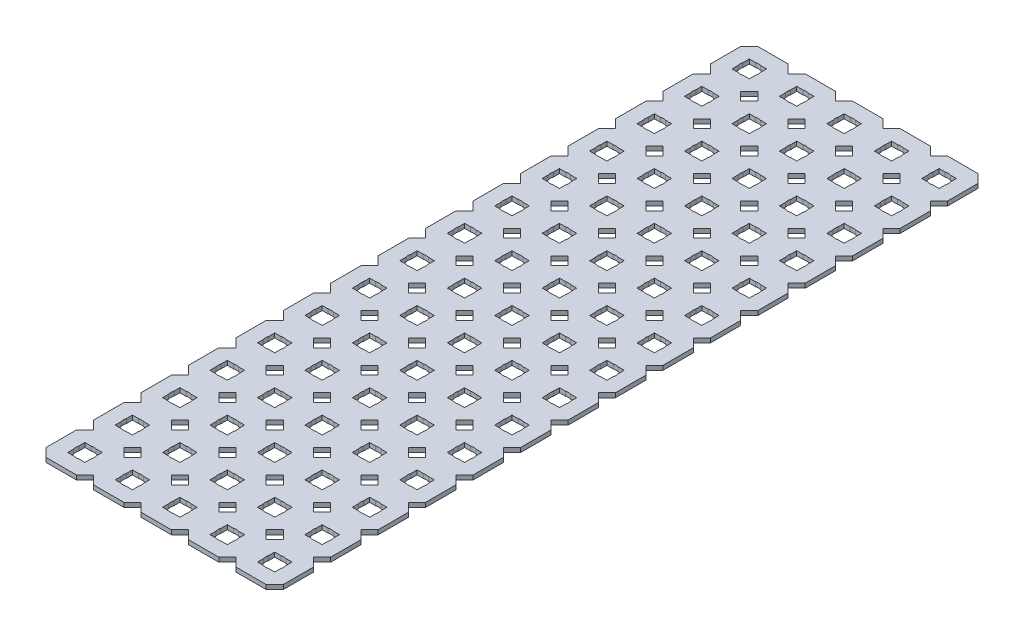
SolidWorks part; units mm, degrees
ref_plane "Front Plane" through (0, 0, 0) normal (0, 0, 1) x (1, 0, 0)
ref_plane "Top Plane" through (0, 0, 0) normal (0, 1, 0) x (1, 0, 0)
ref_plane "Right Plane" through (0, 0, 0) normal (1, 0, 0) x (0, 0, -1)
ref_plane "Plane1" through (0, 0, 0) normal (0, -1, 0) x (1, 0, 0)
sketch "Sketch1" plane through (0, 0, 0) normal (0, -1, 0) x (1, 0, 0)
  line L0 (2.281, -317.5) -> (10.419, -317.5)
  line L1 (10.419, -317.5) -> (12.7, -315.219)
  line L2 (12.7, -315.219) -> (14.981, -317.5)
  line L3 (14.981, -317.5) -> (23.119, -317.5)
  line L4 (23.119, -317.5) -> (25.4, -315.219)
  line L5 (25.4, -315.219) -> (27.681, -317.5)
  line L6 (27.681, -317.5) -> (35.819, -317.5)
  line L7 (35.819, -317.5) -> (38.1, -315.219)
  line L8 (38.1, -315.219) -> (40.381, -317.5)
  line L9 (40.381, -317.5) -> (48.519, -317.5)
  line L10 (48.519, -317.5) -> (50.8, -315.219)
  line L11 (50.8, -315.219) -> (53.081, -317.5)
  line L12 (53.081, -317.5) -> (61.219, -317.5)
  line L13 (61.219, -317.5) -> (63.5, -315.219)
  line L14 (63.5, -315.219) -> (63.5, -307.081)
  line L15 (63.5, -307.081) -> (61.219, -304.8)
  line L16 (61.219, -304.8) -> (63.5, -302.519)
  line L17 (63.5, -302.519) -> (63.5, -294.381)
  line L18 (63.5, -294.381) -> (61.219, -292.1)
  line L19 (61.219, -292.1) -> (63.5, -289.819)
  line L20 (63.5, -289.819) -> (63.5, -281.681)
  line L21 (63.5, -281.681) -> (61.219, -279.4)
  line L22 (61.219, -279.4) -> (63.5, -277.119)
  line L23 (63.5, -277.119) -> (63.5, -268.981)
  line L24 (63.5, -268.981) -> (61.219, -266.7)
  line L25 (61.219, -266.7) -> (63.5, -264.419)
  line L26 (63.5, -264.419) -> (63.5, -256.281)
  line L27 (63.5, -256.281) -> (61.219, -254)
  line L28 (61.219, -254) -> (63.5, -251.719)
  line L29 (63.5, -251.719) -> (63.5, -243.581)
  line L30 (63.5, -243.581) -> (61.219, -241.3)
  line L31 (61.219, -241.3) -> (63.5, -239.019)
  line L32 (63.5, -239.019) -> (63.5, -230.881)
  line L33 (63.5, -230.881) -> (61.219, -228.6)
  line L34 (61.219, -228.6) -> (63.5, -226.319)
  line L35 (63.5, -226.319) -> (63.5, -218.181)
  line L36 (63.5, -218.181) -> (61.219, -215.9)
  line L37 (61.219, -215.9) -> (63.5, -213.619)
  line L38 (63.5, -213.619) -> (63.5, -205.481)
  line L39 (63.5, -205.481) -> (61.219, -203.2)
  line L40 (61.219, -203.2) -> (63.5, -200.919)
  line L41 (63.5, -200.919) -> (63.5, -192.781)
  line L42 (63.5, -192.781) -> (61.219, -190.5)
  line L43 (61.219, -190.5) -> (63.5, -188.219)
  line L44 (63.5, -188.219) -> (63.5, -180.081)
  line L45 (63.5, -180.081) -> (61.219, -177.8)
  line L46 (61.219, -177.8) -> (63.5, -175.519)
  line L47 (63.5, -175.519) -> (63.5, -167.381)
  line L48 (63.5, -167.381) -> (61.219, -165.1)
  line L49 (61.219, -165.1) -> (63.5, -162.819)
  line L50 (63.5, -162.819) -> (63.5, -154.681)
  line L51 (63.5, -154.681) -> (61.219, -152.4)
  line L52 (61.219, -152.4) -> (63.5, -150.119)
  line L53 (63.5, -150.119) -> (63.5, -141.981)
  line L54 (63.5, -141.981) -> (61.219, -139.7)
  line L55 (61.219, -139.7) -> (63.5, -137.419)
  line L56 (63.5, -137.419) -> (63.5, -129.281)
  line L57 (63.5, -129.281) -> (61.219, -127)
  line L58 (61.219, -127) -> (63.5, -124.719)
  line L59 (63.5, -124.719) -> (63.5, -116.581)
  line L60 (63.5, -116.581) -> (61.219, -114.3)
  line L61 (61.219, -114.3) -> (63.5, -112.019)
  line L62 (63.5, -112.019) -> (63.5, -103.881)
  line L63 (63.5, -103.881) -> (61.219, -101.6)
  line L64 (61.219, -101.6) -> (63.5, -99.319)
  line L65 (63.5, -99.319) -> (63.5, -91.181)
  line L66 (63.5, -91.181) -> (61.219, -88.9)
  line L67 (61.219, -88.9) -> (63.5, -86.619)
  line L68 (63.5, -86.619) -> (63.5, -78.481)
  line L69 (63.5, -78.481) -> (61.219, -76.2)
  line L70 (61.219, -76.2) -> (63.5, -73.919)
  line L71 (63.5, -73.919) -> (63.5, -65.781)
  line L72 (63.5, -65.781) -> (61.219, -63.5)
  line L73 (61.219, -63.5) -> (63.5, -61.219)
  line L74 (63.5, -61.219) -> (63.5, -53.081)
  line L75 (63.5, -53.081) -> (61.219, -50.8)
  line L76 (61.219, -50.8) -> (63.5, -48.519)
  line L77 (63.5, -48.519) -> (63.5, -40.381)
  line L78 (63.5, -40.381) -> (61.219, -38.1)
  line L79 (61.219, -38.1) -> (63.5, -35.819)
  line L80 (63.5, -35.819) -> (63.5, -27.681)
  line L81 (63.5, -27.681) -> (61.219, -25.4)
  line L82 (61.219, -25.4) -> (63.5, -23.119)
  line L83 (63.5, -23.119) -> (63.5, -14.981)
  line L84 (63.5, -14.981) -> (61.219, -12.7)
  line L85 (61.219, -12.7) -> (63.5, -10.419)
  line L86 (63.5, -10.419) -> (63.5, -2.281)
  line L87 (63.5, -2.281) -> (61.219, 0)
  line L88 (61.219, 0) -> (53.081, 0)
  line L89 (53.081, 0) -> (50.8, -2.281)
  line L90 (50.8, -2.281) -> (48.519, 0)
  line L91 (48.519, 0) -> (40.381, 0)
  line L92 (40.381, 0) -> (38.1, -2.281)
  line L93 (38.1, -2.281) -> (35.819, 0)
  line L94 (35.819, 0) -> (27.681, 0)
  line L95 (27.681, 0) -> (25.4, -2.281)
  line L96 (25.4, -2.281) -> (23.119, 0)
  line L97 (23.119, 0) -> (14.981, 0)
  line L98 (14.981, 0) -> (12.7, -2.281)
  line L99 (12.7, -2.281) -> (10.419, 0)
  line L100 (10.419, 0) -> (2.281, 0)
  line L101 (2.281, 0) -> (0, -2.281)
  line L102 (0, -2.281) -> (0, -10.419)
  line L103 (0, -10.419) -> (2.281, -12.7)
  line L104 (2.281, -12.7) -> (0, -14.981)
  line L105 (0, -14.981) -> (0, -23.119)
  line L106 (0, -23.119) -> (2.281, -25.4)
  line L107 (2.281, -25.4) -> (0, -27.681)
  line L108 (0, -27.681) -> (0, -35.819)
  line L109 (0, -35.819) -> (2.281, -38.1)
  line L110 (2.281, -38.1) -> (0, -40.381)
  line L111 (0, -40.381) -> (0, -48.519)
  line L112 (0, -48.519) -> (2.281, -50.8)
  line L113 (2.281, -50.8) -> (0, -53.081)
  line L114 (0, -53.081) -> (0, -61.219)
  line L115 (0, -61.219) -> (2.281, -63.5)
  line L116 (2.281, -63.5) -> (0, -65.781)
  line L117 (0, -65.781) -> (0, -73.919)
  line L118 (0, -73.919) -> (2.281, -76.2)
  line L119 (2.281, -76.2) -> (0, -78.481)
  line L120 (0, -78.481) -> (0, -86.619)
  line L121 (0, -86.619) -> (2.281, -88.9)
  line L122 (2.281, -88.9) -> (0, -91.181)
  line L123 (0, -91.181) -> (0, -99.319)
  line L124 (0, -99.319) -> (2.281, -101.6)
  line L125 (2.281, -101.6) -> (0, -103.881)
  line L126 (0, -103.881) -> (0, -112.019)
  line L127 (0, -112.019) -> (2.281, -114.3)
  line L128 (2.281, -114.3) -> (0, -116.581)
  line L129 (0, -116.581) -> (0, -124.719)
  line L130 (0, -124.719) -> (2.281, -127)
  line L131 (2.281, -127) -> (0, -129.281)
  line L132 (0, -129.281) -> (0, -137.419)
  line L133 (0, -137.419) -> (2.281, -139.7)
  line L134 (2.281, -139.7) -> (0, -141.981)
  line L135 (0, -141.981) -> (0, -150.119)
  line L136 (0, -150.119) -> (2.281, -152.4)
  line L137 (2.281, -152.4) -> (0, -154.681)
  line L138 (0, -154.681) -> (0, -162.819)
  line L139 (0, -162.819) -> (2.281, -165.1)
  line L140 (2.281, -165.1) -> (0, -167.381)
  line L141 (0, -167.381) -> (0, -175.519)
  line L142 (0, -175.519) -> (2.281, -177.8)
  line L143 (2.281, -177.8) -> (0, -180.081)
  line L144 (0, -180.081) -> (0, -188.219)
  line L145 (0, -188.219) -> (2.281, -190.5)
  line L146 (2.281, -190.5) -> (0, -192.781)
  line L147 (0, -192.781) -> (0, -200.919)
  line L148 (0, -200.919) -> (2.281, -203.2)
  line L149 (2.281, -203.2) -> (0, -205.481)
  line L150 (0, -205.481) -> (0, -213.619)
  line L151 (0, -213.619) -> (2.281, -215.9)
  line L152 (2.281, -215.9) -> (0, -218.181)
  line L153 (0, -218.181) -> (0, -226.319)
  line L154 (0, -226.319) -> (2.281, -228.6)
  line L155 (2.281, -228.6) -> (0, -230.881)
  line L156 (0, -230.881) -> (0, -239.019)
  line L157 (0, -239.019) -> (2.281, -241.3)
  line L158 (2.281, -241.3) -> (0, -243.581)
  line L159 (0, -243.581) -> (0, -251.719)
  line L160 (0, -251.719) -> (2.281, -254)
  line L161 (2.281, -254) -> (0, -256.281)
  line L162 (0, -256.281) -> (0, -264.419)
  line L163 (0, -264.419) -> (2.281, -266.7)
  line L164 (2.281, -266.7) -> (0, -268.981)
  line L165 (0, -268.981) -> (0, -277.119)
  line L166 (0, -277.119) -> (2.281, -279.4)
  line L167 (2.281, -279.4) -> (0, -281.681)
  line L168 (0, -281.681) -> (0, -289.819)
  line L169 (0, -289.819) -> (2.281, -292.1)
  line L170 (2.281, -292.1) -> (0, -294.381)
  line L171 (0, -294.381) -> (0, -302.519)
  line L172 (0, -302.519) -> (2.281, -304.8)
  line L173 (2.281, -304.8) -> (0, -307.081)
  line L174 (0, -307.081) -> (0, -315.219)
  line L175 (0, -315.219) -> (2.281, -317.5)
  line L176 (14.981, -292.1) -> (12.7, -294.381)
  line L177 (12.7, -294.381) -> (10.419, -292.1)
  line L178 (10.419, -292.1) -> (12.7, -289.819)
  line L179 (12.7, -289.819) -> (14.981, -292.1)
  line L180 (14.981, -266.7) -> (12.7, -268.981)
  line L181 (12.7, -268.981) -> (10.419, -266.7)
  line L182 (10.419, -266.7) -> (12.7, -264.419)
  line L183 (12.7, -264.419) -> (14.981, -266.7)
  line L184 (14.981, -241.3) -> (12.7, -243.581)
  line L185 (12.7, -243.581) -> (10.419, -241.3)
  line L186 (10.419, -241.3) -> (12.7, -239.019)
  line L187 (12.7, -239.019) -> (14.981, -241.3)
  line L188 (14.981, -215.9) -> (12.7, -218.181)
  line L189 (12.7, -218.181) -> (10.419, -215.9)
  line L190 (10.419, -215.9) -> (12.7, -213.619)
  line L191 (12.7, -213.619) -> (14.981, -215.9)
  line L192 (14.981, -190.5) -> (12.7, -192.781)
  line L193 (12.7, -192.781) -> (10.419, -190.5)
  line L194 (10.419, -190.5) -> (12.7, -188.219)
  line L195 (12.7, -188.219) -> (14.981, -190.5)
  line L196 (14.981, -165.1) -> (12.7, -167.381)
  line L197 (12.7, -167.381) -> (10.419, -165.1)
  line L198 (10.419, -165.1) -> (12.7, -162.819)
  line L199 (12.7, -162.819) -> (14.981, -165.1)
  line L200 (14.981, -139.7) -> (12.7, -141.981)
  line L201 (12.7, -141.981) -> (10.419, -139.7)
  line L202 (10.419, -139.7) -> (12.7, -137.419)
  line L203 (12.7, -137.419) -> (14.981, -139.7)
  line L204 (14.981, -114.3) -> (12.7, -116.581)
  line L205 (12.7, -116.581) -> (10.419, -114.3)
  line L206 (10.419, -114.3) -> (12.7, -112.019)
  line L207 (12.7, -112.019) -> (14.981, -114.3)
  line L208 (14.981, -88.9) -> (12.7, -91.181)
  line L209 (12.7, -91.181) -> (10.419, -88.9)
  line L210 (10.419, -88.9) -> (12.7, -86.619)
  line L211 (12.7, -86.619) -> (14.981, -88.9)
  line L212 (14.981, -63.5) -> (12.7, -65.781)
  line L213 (12.7, -65.781) -> (10.419, -63.5)
  line L214 (10.419, -63.5) -> (12.7, -61.219)
  line L215 (12.7, -61.219) -> (14.981, -63.5)
  line L216 (14.981, -38.1) -> (12.7, -40.381)
  line L217 (12.7, -40.381) -> (10.419, -38.1)
  line L218 (10.419, -38.1) -> (12.7, -35.819)
  line L219 (12.7, -35.819) -> (14.981, -38.1)
  line L220 (14.981, -12.7) -> (12.7, -14.981)
  line L221 (12.7, -14.981) -> (10.419, -12.7)
  line L222 (10.419, -12.7) -> (12.7, -10.419)
  line L223 (12.7, -10.419) -> (14.981, -12.7)
  line L224 (27.681, -304.8) -> (25.4, -307.081)
  line L225 (25.4, -307.081) -> (23.119, -304.8)
  line L226 (23.119, -304.8) -> (25.4, -302.519)
  line L227 (25.4, -302.519) -> (27.681, -304.8)
  line L228 (27.681, -279.4) -> (25.4, -281.681)
  line L229 (25.4, -281.681) -> (23.119, -279.4)
  line L230 (23.119, -279.4) -> (25.4, -277.119)
  line L231 (25.4, -277.119) -> (27.681, -279.4)
  line L232 (27.681, -254) -> (25.4, -256.281)
  line L233 (25.4, -256.281) -> (23.119, -254)
  line L234 (23.119, -254) -> (25.4, -251.719)
  line L235 (25.4, -251.719) -> (27.681, -254)
  line L236 (27.681, -228.6) -> (25.4, -230.881)
  line L237 (25.4, -230.881) -> (23.119, -228.6)
  line L238 (23.119, -228.6) -> (25.4, -226.319)
  line L239 (25.4, -226.319) -> (27.681, -228.6)
  line L240 (27.681, -203.2) -> (25.4, -205.481)
  line L241 (25.4, -205.481) -> (23.119, -203.2)
  line L242 (23.119, -203.2) -> (25.4, -200.919)
  line L243 (25.4, -200.919) -> (27.681, -203.2)
  line L244 (27.681, -177.8) -> (25.4, -180.081)
  line L245 (25.4, -180.081) -> (23.119, -177.8)
  line L246 (23.119, -177.8) -> (25.4, -175.519)
  line L247 (25.4, -175.519) -> (27.681, -177.8)
  line L248 (27.681, -152.4) -> (25.4, -154.681)
  line L249 (25.4, -154.681) -> (23.119, -152.4)
  line L250 (23.119, -152.4) -> (25.4, -150.119)
  line L251 (25.4, -150.119) -> (27.681, -152.4)
  line L252 (27.681, -127) -> (25.4, -129.281)
  line L253 (25.4, -129.281) -> (23.119, -127)
  line L254 (23.119, -127) -> (25.4, -124.719)
  line L255 (25.4, -124.719) -> (27.681, -127)
  line L256 (27.681, -101.6) -> (25.4, -103.881)
  line L257 (25.4, -103.881) -> (23.119, -101.6)
  line L258 (23.119, -101.6) -> (25.4, -99.319)
  line L259 (25.4, -99.319) -> (27.681, -101.6)
  line L260 (27.681, -76.2) -> (25.4, -78.481)
  line L261 (25.4, -78.481) -> (23.119, -76.2)
  line L262 (23.119, -76.2) -> (25.4, -73.919)
  line L263 (25.4, -73.919) -> (27.681, -76.2)
  line L264 (27.681, -50.8) -> (25.4, -53.081)
  line L265 (25.4, -53.081) -> (23.119, -50.8)
  line L266 (23.119, -50.8) -> (25.4, -48.519)
  line L267 (25.4, -48.519) -> (27.681, -50.8)
  line L268 (27.681, -25.4) -> (25.4, -27.681)
  line L269 (25.4, -27.681) -> (23.119, -25.4)
  line L270 (23.119, -25.4) -> (25.4, -23.119)
  line L271 (25.4, -23.119) -> (27.681, -25.4)
  line L272 (40.381, -292.1) -> (38.1, -294.381)
  line L273 (38.1, -294.381) -> (35.819, -292.1)
  line L274 (35.819, -292.1) -> (38.1, -289.819)
  line L275 (38.1, -289.819) -> (40.381, -292.1)
  line L276 (40.381, -266.7) -> (38.1, -268.981)
  line L277 (38.1, -268.981) -> (35.819, -266.7)
  line L278 (35.819, -266.7) -> (38.1, -264.419)
  line L279 (38.1, -264.419) -> (40.381, -266.7)
  line L280 (40.381, -241.3) -> (38.1, -243.581)
  line L281 (38.1, -243.581) -> (35.819, -241.3)
  line L282 (35.819, -241.3) -> (38.1, -239.019)
  line L283 (38.1, -239.019) -> (40.381, -241.3)
  line L284 (40.381, -215.9) -> (38.1, -218.181)
  line L285 (38.1, -218.181) -> (35.819, -215.9)
  line L286 (35.819, -215.9) -> (38.1, -213.619)
  line L287 (38.1, -213.619) -> (40.381, -215.9)
  line L288 (40.381, -190.5) -> (38.1, -192.781)
  line L289 (38.1, -192.781) -> (35.819, -190.5)
  line L290 (35.819, -190.5) -> (38.1, -188.219)
  line L291 (38.1, -188.219) -> (40.381, -190.5)
  line L292 (40.381, -165.1) -> (38.1, -167.381)
  line L293 (38.1, -167.381) -> (35.819, -165.1)
  line L294 (35.819, -165.1) -> (38.1, -162.819)
  line L295 (38.1, -162.819) -> (40.381, -165.1)
  line L296 (40.381, -139.7) -> (38.1, -141.981)
  line L297 (38.1, -141.981) -> (35.819, -139.7)
  line L298 (35.819, -139.7) -> (38.1, -137.419)
  line L299 (38.1, -137.419) -> (40.381, -139.7)
  line L300 (40.381, -114.3) -> (38.1, -116.581)
  line L301 (38.1, -116.581) -> (35.819, -114.3)
  line L302 (35.819, -114.3) -> (38.1, -112.019)
  line L303 (38.1, -112.019) -> (40.381, -114.3)
  line L304 (40.381, -88.9) -> (38.1, -91.181)
  line L305 (38.1, -91.181) -> (35.819, -88.9)
  line L306 (35.819, -88.9) -> (38.1, -86.619)
  line L307 (38.1, -86.619) -> (40.381, -88.9)
  line L308 (40.381, -63.5) -> (38.1, -65.781)
  line L309 (38.1, -65.781) -> (35.819, -63.5)
  line L310 (35.819, -63.5) -> (38.1, -61.219)
  line L311 (38.1, -61.219) -> (40.381, -63.5)
  line L312 (40.381, -38.1) -> (38.1, -40.381)
  line L313 (38.1, -40.381) -> (35.819, -38.1)
  line L314 (35.819, -38.1) -> (38.1, -35.819)
  line L315 (38.1, -35.819) -> (40.381, -38.1)
  line L316 (40.381, -12.7) -> (38.1, -14.981)
  line L317 (38.1, -14.981) -> (35.819, -12.7)
  line L318 (35.819, -12.7) -> (38.1, -10.419)
  line L319 (38.1, -10.419) -> (40.381, -12.7)
  line L320 (53.081, -304.8) -> (50.8, -307.081)
  line L321 (50.8, -307.081) -> (48.519, -304.8)
  line L322 (48.519, -304.8) -> (50.8, -302.519)
  line L323 (50.8, -302.519) -> (53.081, -304.8)
  line L324 (53.081, -279.4) -> (50.8, -281.681)
  line L325 (50.8, -281.681) -> (48.519, -279.4)
  line L326 (48.519, -279.4) -> (50.8, -277.119)
  line L327 (50.8, -277.119) -> (53.081, -279.4)
  line L328 (53.081, -254) -> (50.8, -256.281)
  line L329 (50.8, -256.281) -> (48.519, -254)
  line L330 (48.519, -254) -> (50.8, -251.719)
  line L331 (50.8, -251.719) -> (53.081, -254)
  line L332 (53.081, -228.6) -> (50.8, -230.881)
  line L333 (50.8, -230.881) -> (48.519, -228.6)
  line L334 (48.519, -228.6) -> (50.8, -226.319)
  line L335 (50.8, -226.319) -> (53.081, -228.6)
  line L336 (53.081, -203.2) -> (50.8, -205.481)
  line L337 (50.8, -205.481) -> (48.519, -203.2)
  line L338 (48.519, -203.2) -> (50.8, -200.919)
  line L339 (50.8, -200.919) -> (53.081, -203.2)
  line L340 (53.081, -177.8) -> (50.8, -180.081)
  line L341 (50.8, -180.081) -> (48.519, -177.8)
  line L342 (48.519, -177.8) -> (50.8, -175.519)
  line L343 (50.8, -175.519) -> (53.081, -177.8)
  line L344 (53.081, -152.4) -> (50.8, -154.681)
  line L345 (50.8, -154.681) -> (48.519, -152.4)
  line L346 (48.519, -152.4) -> (50.8, -150.119)
  line L347 (50.8, -150.119) -> (53.081, -152.4)
  line L348 (53.081, -127) -> (50.8, -129.281)
  line L349 (50.8, -129.281) -> (48.519, -127)
  line L350 (48.519, -127) -> (50.8, -124.719)
  line L351 (50.8, -124.719) -> (53.081, -127)
  line L352 (53.081, -101.6) -> (50.8, -103.881)
  line L353 (50.8, -103.881) -> (48.519, -101.6)
  line L354 (48.519, -101.6) -> (50.8, -99.319)
  line L355 (50.8, -99.319) -> (53.081, -101.6)
  line L356 (53.081, -76.2) -> (50.8, -78.481)
  line L357 (50.8, -78.481) -> (48.519, -76.2)
  line L358 (48.519, -76.2) -> (50.8, -73.919)
  line L359 (50.8, -73.919) -> (53.081, -76.2)
  line L360 (53.081, -50.8) -> (50.8, -53.081)
  line L361 (50.8, -53.081) -> (48.519, -50.8)
  line L362 (48.519, -50.8) -> (50.8, -48.519)
  line L363 (50.8, -48.519) -> (53.081, -50.8)
  line L364 (53.081, -25.4) -> (50.8, -27.681)
  line L365 (50.8, -27.681) -> (48.519, -25.4)
  line L366 (48.519, -25.4) -> (50.8, -23.119)
  line L367 (50.8, -23.119) -> (53.081, -25.4)
  line L368 (4.0386, -308.8386) -> (8.6614, -308.8386)
  line L369 (8.6614, -308.8386) -> (8.6614, -313.4614)
  line L370 (8.6614, -313.4614) -> (4.0386, -313.4614)
  line L371 (4.0386, -313.4614) -> (4.0386, -308.8386)
  line L372 (16.7386, -308.8386) -> (21.3614, -308.8386)
  line L373 (21.3614, -308.8386) -> (21.3614, -313.4614)
  line L374 (21.3614, -313.4614) -> (16.7386, -313.4614)
  line L375 (16.7386, -313.4614) -> (16.7386, -308.8386)
  line L376 (29.4386, -308.8386) -> (34.0614, -308.8386)
  line L377 (34.0614, -308.8386) -> (34.0614, -313.4614)
  line L378 (34.0614, -313.4614) -> (29.4386, -313.4614)
  line L379 (29.4386, -313.4614) -> (29.4386, -308.8386)
  line L380 (42.1386, -308.8386) -> (46.7614, -308.8386)
  line L381 (46.7614, -308.8386) -> (46.7614, -313.4614)
  line L382 (46.7614, -313.4614) -> (42.1386, -313.4614)
  line L383 (42.1386, -313.4614) -> (42.1386, -308.8386)
  line L384 (54.8386, -308.8386) -> (59.4614, -308.8386)
  line L385 (59.4614, -308.8386) -> (59.4614, -313.4614)
  line L386 (59.4614, -313.4614) -> (54.8386, -313.4614)
  line L387 (54.8386, -313.4614) -> (54.8386, -308.8386)
  line L388 (4.0386, -296.1386) -> (8.6614, -296.1386)
  line L389 (8.6614, -296.1386) -> (8.6614, -300.7614)
  line L390 (8.6614, -300.7614) -> (4.0386, -300.7614)
  line L391 (4.0386, -300.7614) -> (4.0386, -296.1386)
  line L392 (54.8386, -296.1386) -> (59.4614, -296.1386)
  line L393 (59.4614, -296.1386) -> (59.4614, -300.7614)
  line L394 (59.4614, -300.7614) -> (54.8386, -300.7614)
  line L395 (54.8386, -300.7614) -> (54.8386, -296.1386)
  line L396 (4.0386, -283.4386) -> (8.6614, -283.4386)
  line L397 (8.6614, -283.4386) -> (8.6614, -288.0614)
  line L398 (8.6614, -288.0614) -> (4.0386, -288.0614)
  line L399 (4.0386, -288.0614) -> (4.0386, -283.4386)
  line L400 (54.8386, -283.4386) -> (59.4614, -283.4386)
  line L401 (59.4614, -283.4386) -> (59.4614, -288.0614)
  line L402 (59.4614, -288.0614) -> (54.8386, -288.0614)
  line L403 (54.8386, -288.0614) -> (54.8386, -283.4386)
  line L404 (4.0386, -270.7386) -> (8.6614, -270.7386)
  line L405 (8.6614, -270.7386) -> (8.6614, -275.3614)
  line L406 (8.6614, -275.3614) -> (4.0386, -275.3614)
  line L407 (4.0386, -275.3614) -> (4.0386, -270.7386)
  line L408 (54.8386, -270.7386) -> (59.4614, -270.7386)
  line L409 (59.4614, -270.7386) -> (59.4614, -275.3614)
  line L410 (59.4614, -275.3614) -> (54.8386, -275.3614)
  line L411 (54.8386, -275.3614) -> (54.8386, -270.7386)
  line L412 (4.0386, -258.0386) -> (8.6614, -258.0386)
  line L413 (8.6614, -258.0386) -> (8.6614, -262.6614)
  line L414 (8.6614, -262.6614) -> (4.0386, -262.6614)
  line L415 (4.0386, -262.6614) -> (4.0386, -258.0386)
  line L416 (54.8386, -258.0386) -> (59.4614, -258.0386)
  line L417 (59.4614, -258.0386) -> (59.4614, -262.6614)
  line L418 (59.4614, -262.6614) -> (54.8386, -262.6614)
  line L419 (54.8386, -262.6614) -> (54.8386, -258.0386)
  line L420 (4.0386, -245.3386) -> (8.6614, -245.3386)
  line L421 (8.6614, -245.3386) -> (8.6614, -249.9614)
  line L422 (8.6614, -249.9614) -> (4.0386, -249.9614)
  line L423 (4.0386, -249.9614) -> (4.0386, -245.3386)
  line L424 (54.8386, -245.3386) -> (59.4614, -245.3386)
  line L425 (59.4614, -245.3386) -> (59.4614, -249.9614)
  line L426 (59.4614, -249.9614) -> (54.8386, -249.9614)
  line L427 (54.8386, -249.9614) -> (54.8386, -245.3386)
  line L428 (4.0386, -232.6386) -> (8.6614, -232.6386)
  line L429 (8.6614, -232.6386) -> (8.6614, -237.2614)
  line L430 (8.6614, -237.2614) -> (4.0386, -237.2614)
  line L431 (4.0386, -237.2614) -> (4.0386, -232.6386)
  line L432 (54.8386, -232.6386) -> (59.4614, -232.6386)
  line L433 (59.4614, -232.6386) -> (59.4614, -237.2614)
  line L434 (59.4614, -237.2614) -> (54.8386, -237.2614)
  line L435 (54.8386, -237.2614) -> (54.8386, -232.6386)
  line L436 (4.0386, -219.9386) -> (8.6614, -219.9386)
  line L437 (8.6614, -219.9386) -> (8.6614, -224.5614)
  line L438 (8.6614, -224.5614) -> (4.0386, -224.5614)
  line L439 (4.0386, -224.5614) -> (4.0386, -219.9386)
  line L440 (54.8386, -219.9386) -> (59.4614, -219.9386)
  line L441 (59.4614, -219.9386) -> (59.4614, -224.5614)
  line L442 (59.4614, -224.5614) -> (54.8386, -224.5614)
  line L443 (54.8386, -224.5614) -> (54.8386, -219.9386)
  line L444 (4.0386, -207.2386) -> (8.6614, -207.2386)
  line L445 (8.6614, -207.2386) -> (8.6614, -211.8614)
  line L446 (8.6614, -211.8614) -> (4.0386, -211.8614)
  line L447 (4.0386, -211.8614) -> (4.0386, -207.2386)
  line L448 (54.8386, -207.2386) -> (59.4614, -207.2386)
  line L449 (59.4614, -207.2386) -> (59.4614, -211.8614)
  line L450 (59.4614, -211.8614) -> (54.8386, -211.8614)
  line L451 (54.8386, -211.8614) -> (54.8386, -207.2386)
  line L452 (4.0386, -194.5386) -> (8.6614, -194.5386)
  line L453 (8.6614, -194.5386) -> (8.6614, -199.1614)
  line L454 (8.6614, -199.1614) -> (4.0386, -199.1614)
  line L455 (4.0386, -199.1614) -> (4.0386, -194.5386)
  line L456 (54.8386, -194.5386) -> (59.4614, -194.5386)
  line L457 (59.4614, -194.5386) -> (59.4614, -199.1614)
  line L458 (59.4614, -199.1614) -> (54.8386, -199.1614)
  line L459 (54.8386, -199.1614) -> (54.8386, -194.5386)
  line L460 (4.0386, -181.8386) -> (8.6614, -181.8386)
  line L461 (8.6614, -181.8386) -> (8.6614, -186.4614)
  line L462 (8.6614, -186.4614) -> (4.0386, -186.4614)
  line L463 (4.0386, -186.4614) -> (4.0386, -181.8386)
  line L464 (54.8386, -181.8386) -> (59.4614, -181.8386)
  line L465 (59.4614, -181.8386) -> (59.4614, -186.4614)
  line L466 (59.4614, -186.4614) -> (54.8386, -186.4614)
  line L467 (54.8386, -186.4614) -> (54.8386, -181.8386)
  line L468 (4.0386, -169.1386) -> (8.6614, -169.1386)
  line L469 (8.6614, -169.1386) -> (8.6614, -173.7614)
  line L470 (8.6614, -173.7614) -> (4.0386, -173.7614)
  line L471 (4.0386, -173.7614) -> (4.0386, -169.1386)
  line L472 (54.8386, -169.1386) -> (59.4614, -169.1386)
  line L473 (59.4614, -169.1386) -> (59.4614, -173.7614)
  line L474 (59.4614, -173.7614) -> (54.8386, -173.7614)
  line L475 (54.8386, -173.7614) -> (54.8386, -169.1386)
  line L476 (4.0386, -156.4386) -> (8.6614, -156.4386)
  line L477 (8.6614, -156.4386) -> (8.6614, -161.0614)
  line L478 (8.6614, -161.0614) -> (4.0386, -161.0614)
  line L479 (4.0386, -161.0614) -> (4.0386, -156.4386)
  line L480 (54.8386, -156.4386) -> (59.4614, -156.4386)
  line L481 (59.4614, -156.4386) -> (59.4614, -161.0614)
  line L482 (59.4614, -161.0614) -> (54.8386, -161.0614)
  line L483 (54.8386, -161.0614) -> (54.8386, -156.4386)
  line L484 (4.0386, -143.7386) -> (8.6614, -143.7386)
  line L485 (8.6614, -143.7386) -> (8.6614, -148.3614)
  line L486 (8.6614, -148.3614) -> (4.0386, -148.3614)
  line L487 (4.0386, -148.3614) -> (4.0386, -143.7386)
  line L488 (54.8386, -143.7386) -> (59.4614, -143.7386)
  line L489 (59.4614, -143.7386) -> (59.4614, -148.3614)
  line L490 (59.4614, -148.3614) -> (54.8386, -148.3614)
  line L491 (54.8386, -148.3614) -> (54.8386, -143.7386)
  line L492 (4.0386, -131.0386) -> (8.6614, -131.0386)
  line L493 (8.6614, -131.0386) -> (8.6614, -135.6614)
  line L494 (8.6614, -135.6614) -> (4.0386, -135.6614)
  line L495 (4.0386, -135.6614) -> (4.0386, -131.0386)
  line L496 (54.8386, -131.0386) -> (59.4614, -131.0386)
  line L497 (59.4614, -131.0386) -> (59.4614, -135.6614)
  line L498 (59.4614, -135.6614) -> (54.8386, -135.6614)
  line L499 (54.8386, -135.6614) -> (54.8386, -131.0386)
  line L500 (4.0386, -118.3386) -> (8.6614, -118.3386)
  line L501 (8.6614, -118.3386) -> (8.6614, -122.9614)
  line L502 (8.6614, -122.9614) -> (4.0386, -122.9614)
  line L503 (4.0386, -122.9614) -> (4.0386, -118.3386)
  line L504 (54.8386, -118.3386) -> (59.4614, -118.3386)
  line L505 (59.4614, -118.3386) -> (59.4614, -122.9614)
  line L506 (59.4614, -122.9614) -> (54.8386, -122.9614)
  line L507 (54.8386, -122.9614) -> (54.8386, -118.3386)
  line L508 (4.0386, -105.6386) -> (8.6614, -105.6386)
  line L509 (8.6614, -105.6386) -> (8.6614, -110.2614)
  line L510 (8.6614, -110.2614) -> (4.0386, -110.2614)
  line L511 (4.0386, -110.2614) -> (4.0386, -105.6386)
  line L512 (54.8386, -105.6386) -> (59.4614, -105.6386)
  line L513 (59.4614, -105.6386) -> (59.4614, -110.2614)
  line L514 (59.4614, -110.2614) -> (54.8386, -110.2614)
  line L515 (54.8386, -110.2614) -> (54.8386, -105.6386)
  line L516 (4.0386, -92.9386) -> (8.6614, -92.9386)
  line L517 (8.6614, -92.9386) -> (8.6614, -97.5614)
  line L518 (8.6614, -97.5614) -> (4.0386, -97.5614)
  line L519 (4.0386, -97.5614) -> (4.0386, -92.9386)
  line L520 (54.8386, -92.9386) -> (59.4614, -92.9386)
  line L521 (59.4614, -92.9386) -> (59.4614, -97.5614)
  line L522 (59.4614, -97.5614) -> (54.8386, -97.5614)
  line L523 (54.8386, -97.5614) -> (54.8386, -92.9386)
  line L524 (4.0386, -80.2386) -> (8.6614, -80.2386)
  line L525 (8.6614, -80.2386) -> (8.6614, -84.8614)
  line L526 (8.6614, -84.8614) -> (4.0386, -84.8614)
  line L527 (4.0386, -84.8614) -> (4.0386, -80.2386)
  line L528 (54.8386, -80.2386) -> (59.4614, -80.2386)
  line L529 (59.4614, -80.2386) -> (59.4614, -84.8614)
  line L530 (59.4614, -84.8614) -> (54.8386, -84.8614)
  line L531 (54.8386, -84.8614) -> (54.8386, -80.2386)
  line L532 (4.0386, -67.5386) -> (8.6614, -67.5386)
  line L533 (8.6614, -67.5386) -> (8.6614, -72.1614)
  line L534 (8.6614, -72.1614) -> (4.0386, -72.1614)
  line L535 (4.0386, -72.1614) -> (4.0386, -67.5386)
  line L536 (54.8386, -67.5386) -> (59.4614, -67.5386)
  line L537 (59.4614, -67.5386) -> (59.4614, -72.1614)
  line L538 (59.4614, -72.1614) -> (54.8386, -72.1614)
  line L539 (54.8386, -72.1614) -> (54.8386, -67.5386)
  line L540 (4.0386, -54.8386) -> (8.6614, -54.8386)
  line L541 (8.6614, -54.8386) -> (8.6614, -59.4614)
  line L542 (8.6614, -59.4614) -> (4.0386, -59.4614)
  line L543 (4.0386, -59.4614) -> (4.0386, -54.8386)
  line L544 (54.8386, -54.8386) -> (59.4614, -54.8386)
  line L545 (59.4614, -54.8386) -> (59.4614, -59.4614)
  line L546 (59.4614, -59.4614) -> (54.8386, -59.4614)
  line L547 (54.8386, -59.4614) -> (54.8386, -54.8386)
  line L548 (4.0386, -42.1386) -> (8.6614, -42.1386)
  line L549 (8.6614, -42.1386) -> (8.6614, -46.7614)
  line L550 (8.6614, -46.7614) -> (4.0386, -46.7614)
  line L551 (4.0386, -46.7614) -> (4.0386, -42.1386)
  line L552 (54.8386, -42.1386) -> (59.4614, -42.1386)
  line L553 (59.4614, -42.1386) -> (59.4614, -46.7614)
  line L554 (59.4614, -46.7614) -> (54.8386, -46.7614)
  line L555 (54.8386, -46.7614) -> (54.8386, -42.1386)
  line L556 (4.0386, -29.4386) -> (8.6614, -29.4386)
  line L557 (8.6614, -29.4386) -> (8.6614, -34.0614)
  line L558 (8.6614, -34.0614) -> (4.0386, -34.0614)
  line L559 (4.0386, -34.0614) -> (4.0386, -29.4386)
  line L560 (54.8386, -29.4386) -> (59.4614, -29.4386)
  line L561 (59.4614, -29.4386) -> (59.4614, -34.0614)
  line L562 (59.4614, -34.0614) -> (54.8386, -34.0614)
  line L563 (54.8386, -34.0614) -> (54.8386, -29.4386)
  line L564 (4.0386, -16.7386) -> (8.6614, -16.7386)
  line L565 (8.6614, -16.7386) -> (8.6614, -21.3614)
  line L566 (8.6614, -21.3614) -> (4.0386, -21.3614)
  line L567 (4.0386, -21.3614) -> (4.0386, -16.7386)
  line L568 (54.8386, -16.7386) -> (59.4614, -16.7386)
  line L569 (59.4614, -16.7386) -> (59.4614, -21.3614)
  line L570 (59.4614, -21.3614) -> (54.8386, -21.3614)
  line L571 (54.8386, -21.3614) -> (54.8386, -16.7386)
  line L572 (4.0386, -4.0386) -> (8.6614, -4.0386)
  line L573 (8.6614, -4.0386) -> (8.6614, -8.6614)
  line L574 (8.6614, -8.6614) -> (4.0386, -8.6614)
  line L575 (4.0386, -8.6614) -> (4.0386, -4.0386)
  line L576 (16.7386, -4.0386) -> (21.3614, -4.0386)
  line L577 (21.3614, -4.0386) -> (21.3614, -8.6614)
  line L578 (21.3614, -8.6614) -> (16.7386, -8.6614)
  line L579 (16.7386, -8.6614) -> (16.7386, -4.0386)
  line L580 (29.4386, -4.0386) -> (34.0614, -4.0386)
  line L581 (34.0614, -4.0386) -> (34.0614, -8.6614)
  line L582 (34.0614, -8.6614) -> (29.4386, -8.6614)
  line L583 (29.4386, -8.6614) -> (29.4386, -4.0386)
  line L584 (16.7386, -296.1386) -> (21.3614, -296.1386)
  line L585 (21.3614, -296.1386) -> (21.3614, -300.7614)
  line L586 (21.3614, -300.7614) -> (16.7386, -300.7614)
  line L587 (16.7386, -300.7614) -> (16.7386, -296.1386)
  line L588 (29.4386, -296.1386) -> (34.0614, -296.1386)
  line L589 (34.0614, -296.1386) -> (34.0614, -300.7614)
  line L590 (34.0614, -300.7614) -> (29.4386, -300.7614)
  line L591 (29.4386, -300.7614) -> (29.4386, -296.1386)
  line L592 (42.1386, -296.1386) -> (46.7614, -296.1386)
  line L593 (46.7614, -296.1386) -> (46.7614, -300.7614)
  line L594 (46.7614, -300.7614) -> (42.1386, -300.7614)
  line L595 (42.1386, -300.7614) -> (42.1386, -296.1386)
  line L596 (16.7386, -283.4386) -> (21.3614, -283.4386)
  line L597 (21.3614, -283.4386) -> (21.3614, -288.0614)
  line L598 (21.3614, -288.0614) -> (16.7386, -288.0614)
  line L599 (16.7386, -288.0614) -> (16.7386, -283.4386)
  line L600 (29.4386, -283.4386) -> (34.0614, -283.4386)
  line L601 (34.0614, -283.4386) -> (34.0614, -288.0614)
  line L602 (34.0614, -288.0614) -> (29.4386, -288.0614)
  line L603 (29.4386, -288.0614) -> (29.4386, -283.4386)
  line L604 (42.1386, -283.4386) -> (46.7614, -283.4386)
  line L605 (46.7614, -283.4386) -> (46.7614, -288.0614)
  line L606 (46.7614, -288.0614) -> (42.1386, -288.0614)
  line L607 (42.1386, -288.0614) -> (42.1386, -283.4386)
  line L608 (16.7386, -270.7386) -> (21.3614, -270.7386)
  line L609 (21.3614, -270.7386) -> (21.3614, -275.3614)
  line L610 (21.3614, -275.3614) -> (16.7386, -275.3614)
  line L611 (16.7386, -275.3614) -> (16.7386, -270.7386)
  line L612 (29.4386, -270.7386) -> (34.0614, -270.7386)
  line L613 (34.0614, -270.7386) -> (34.0614, -275.3614)
  line L614 (34.0614, -275.3614) -> (29.4386, -275.3614)
  line L615 (29.4386, -275.3614) -> (29.4386, -270.7386)
  line L616 (42.1386, -270.7386) -> (46.7614, -270.7386)
  line L617 (46.7614, -270.7386) -> (46.7614, -275.3614)
  line L618 (46.7614, -275.3614) -> (42.1386, -275.3614)
  line L619 (42.1386, -275.3614) -> (42.1386, -270.7386)
  line L620 (16.7386, -258.0386) -> (21.3614, -258.0386)
  line L621 (21.3614, -258.0386) -> (21.3614, -262.6614)
  line L622 (21.3614, -262.6614) -> (16.7386, -262.6614)
  line L623 (16.7386, -262.6614) -> (16.7386, -258.0386)
  line L624 (29.4386, -258.0386) -> (34.0614, -258.0386)
  line L625 (34.0614, -258.0386) -> (34.0614, -262.6614)
  line L626 (34.0614, -262.6614) -> (29.4386, -262.6614)
  line L627 (29.4386, -262.6614) -> (29.4386, -258.0386)
  line L628 (42.1386, -258.0386) -> (46.7614, -258.0386)
  line L629 (46.7614, -258.0386) -> (46.7614, -262.6614)
  line L630 (46.7614, -262.6614) -> (42.1386, -262.6614)
  line L631 (42.1386, -262.6614) -> (42.1386, -258.0386)
  line L632 (16.7386, -245.3386) -> (21.3614, -245.3386)
  line L633 (21.3614, -245.3386) -> (21.3614, -249.9614)
  line L634 (21.3614, -249.9614) -> (16.7386, -249.9614)
  line L635 (16.7386, -249.9614) -> (16.7386, -245.3386)
  line L636 (29.4386, -245.3386) -> (34.0614, -245.3386)
  line L637 (34.0614, -245.3386) -> (34.0614, -249.9614)
  line L638 (34.0614, -249.9614) -> (29.4386, -249.9614)
  line L639 (29.4386, -249.9614) -> (29.4386, -245.3386)
  line L640 (42.1386, -245.3386) -> (46.7614, -245.3386)
  line L641 (46.7614, -245.3386) -> (46.7614, -249.9614)
  line L642 (46.7614, -249.9614) -> (42.1386, -249.9614)
  line L643 (42.1386, -249.9614) -> (42.1386, -245.3386)
  line L644 (16.7386, -232.6386) -> (21.3614, -232.6386)
  line L645 (21.3614, -232.6386) -> (21.3614, -237.2614)
  line L646 (21.3614, -237.2614) -> (16.7386, -237.2614)
  line L647 (16.7386, -237.2614) -> (16.7386, -232.6386)
  line L648 (29.4386, -232.6386) -> (34.0614, -232.6386)
  line L649 (34.0614, -232.6386) -> (34.0614, -237.2614)
  line L650 (34.0614, -237.2614) -> (29.4386, -237.2614)
  line L651 (29.4386, -237.2614) -> (29.4386, -232.6386)
  line L652 (42.1386, -232.6386) -> (46.7614, -232.6386)
  line L653 (46.7614, -232.6386) -> (46.7614, -237.2614)
  line L654 (46.7614, -237.2614) -> (42.1386, -237.2614)
  line L655 (42.1386, -237.2614) -> (42.1386, -232.6386)
  line L656 (16.7386, -219.9386) -> (21.3614, -219.9386)
  line L657 (21.3614, -219.9386) -> (21.3614, -224.5614)
  line L658 (21.3614, -224.5614) -> (16.7386, -224.5614)
  line L659 (16.7386, -224.5614) -> (16.7386, -219.9386)
  line L660 (29.4386, -219.9386) -> (34.0614, -219.9386)
  line L661 (34.0614, -219.9386) -> (34.0614, -224.5614)
  line L662 (34.0614, -224.5614) -> (29.4386, -224.5614)
  line L663 (29.4386, -224.5614) -> (29.4386, -219.9386)
  line L664 (42.1386, -219.9386) -> (46.7614, -219.9386)
  line L665 (46.7614, -219.9386) -> (46.7614, -224.5614)
  line L666 (46.7614, -224.5614) -> (42.1386, -224.5614)
  line L667 (42.1386, -224.5614) -> (42.1386, -219.9386)
  line L668 (16.7386, -207.2386) -> (21.3614, -207.2386)
  line L669 (21.3614, -207.2386) -> (21.3614, -211.8614)
  line L670 (21.3614, -211.8614) -> (16.7386, -211.8614)
  line L671 (16.7386, -211.8614) -> (16.7386, -207.2386)
  line L672 (29.4386, -207.2386) -> (34.0614, -207.2386)
  line L673 (34.0614, -207.2386) -> (34.0614, -211.8614)
  line L674 (34.0614, -211.8614) -> (29.4386, -211.8614)
  line L675 (29.4386, -211.8614) -> (29.4386, -207.2386)
  line L676 (42.1386, -207.2386) -> (46.7614, -207.2386)
  line L677 (46.7614, -207.2386) -> (46.7614, -211.8614)
  line L678 (46.7614, -211.8614) -> (42.1386, -211.8614)
  line L679 (42.1386, -211.8614) -> (42.1386, -207.2386)
  line L680 (16.7386, -194.5386) -> (21.3614, -194.5386)
  line L681 (21.3614, -194.5386) -> (21.3614, -199.1614)
  line L682 (21.3614, -199.1614) -> (16.7386, -199.1614)
  line L683 (16.7386, -199.1614) -> (16.7386, -194.5386)
  line L684 (29.4386, -194.5386) -> (34.0614, -194.5386)
  line L685 (34.0614, -194.5386) -> (34.0614, -199.1614)
  line L686 (34.0614, -199.1614) -> (29.4386, -199.1614)
  line L687 (29.4386, -199.1614) -> (29.4386, -194.5386)
  line L688 (42.1386, -194.5386) -> (46.7614, -194.5386)
  line L689 (46.7614, -194.5386) -> (46.7614, -199.1614)
  line L690 (46.7614, -199.1614) -> (42.1386, -199.1614)
  line L691 (42.1386, -199.1614) -> (42.1386, -194.5386)
  line L692 (16.7386, -181.8386) -> (21.3614, -181.8386)
  line L693 (21.3614, -181.8386) -> (21.3614, -186.4614)
  line L694 (21.3614, -186.4614) -> (16.7386, -186.4614)
  line L695 (16.7386, -186.4614) -> (16.7386, -181.8386)
  line L696 (29.4386, -181.8386) -> (34.0614, -181.8386)
  line L697 (34.0614, -181.8386) -> (34.0614, -186.4614)
  line L698 (34.0614, -186.4614) -> (29.4386, -186.4614)
  line L699 (29.4386, -186.4614) -> (29.4386, -181.8386)
  line L700 (42.1386, -181.8386) -> (46.7614, -181.8386)
  line L701 (46.7614, -181.8386) -> (46.7614, -186.4614)
  line L702 (46.7614, -186.4614) -> (42.1386, -186.4614)
  line L703 (42.1386, -186.4614) -> (42.1386, -181.8386)
  line L704 (16.7386, -169.1386) -> (21.3614, -169.1386)
  line L705 (21.3614, -169.1386) -> (21.3614, -173.7614)
  line L706 (21.3614, -173.7614) -> (16.7386, -173.7614)
  line L707 (16.7386, -173.7614) -> (16.7386, -169.1386)
  line L708 (29.4386, -169.1386) -> (34.0614, -169.1386)
  line L709 (34.0614, -169.1386) -> (34.0614, -173.7614)
  line L710 (34.0614, -173.7614) -> (29.4386, -173.7614)
  line L711 (29.4386, -173.7614) -> (29.4386, -169.1386)
  line L712 (42.1386, -169.1386) -> (46.7614, -169.1386)
  line L713 (46.7614, -169.1386) -> (46.7614, -173.7614)
  line L714 (46.7614, -173.7614) -> (42.1386, -173.7614)
  line L715 (42.1386, -173.7614) -> (42.1386, -169.1386)
  line L716 (16.7386, -156.4386) -> (21.3614, -156.4386)
  line L717 (21.3614, -156.4386) -> (21.3614, -161.0614)
  line L718 (21.3614, -161.0614) -> (16.7386, -161.0614)
  line L719 (16.7386, -161.0614) -> (16.7386, -156.4386)
  line L720 (29.4386, -156.4386) -> (34.0614, -156.4386)
  line L721 (34.0614, -156.4386) -> (34.0614, -161.0614)
  line L722 (34.0614, -161.0614) -> (29.4386, -161.0614)
  line L723 (29.4386, -161.0614) -> (29.4386, -156.4386)
  line L724 (42.1386, -156.4386) -> (46.7614, -156.4386)
  line L725 (46.7614, -156.4386) -> (46.7614, -161.0614)
  line L726 (46.7614, -161.0614) -> (42.1386, -161.0614)
  line L727 (42.1386, -161.0614) -> (42.1386, -156.4386)
  line L728 (16.7386, -143.7386) -> (21.3614, -143.7386)
  line L729 (21.3614, -143.7386) -> (21.3614, -148.3614)
  line L730 (21.3614, -148.3614) -> (16.7386, -148.3614)
  line L731 (16.7386, -148.3614) -> (16.7386, -143.7386)
  line L732 (29.4386, -143.7386) -> (34.0614, -143.7386)
  line L733 (34.0614, -143.7386) -> (34.0614, -148.3614)
  line L734 (34.0614, -148.3614) -> (29.4386, -148.3614)
  line L735 (29.4386, -148.3614) -> (29.4386, -143.7386)
  line L736 (42.1386, -143.7386) -> (46.7614, -143.7386)
  line L737 (46.7614, -143.7386) -> (46.7614, -148.3614)
  line L738 (46.7614, -148.3614) -> (42.1386, -148.3614)
  line L739 (42.1386, -148.3614) -> (42.1386, -143.7386)
  line L740 (16.7386, -131.0386) -> (21.3614, -131.0386)
  line L741 (21.3614, -131.0386) -> (21.3614, -135.6614)
  line L742 (21.3614, -135.6614) -> (16.7386, -135.6614)
  line L743 (16.7386, -135.6614) -> (16.7386, -131.0386)
  line L744 (29.4386, -131.0386) -> (34.0614, -131.0386)
  line L745 (34.0614, -131.0386) -> (34.0614, -135.6614)
  line L746 (34.0614, -135.6614) -> (29.4386, -135.6614)
  line L747 (29.4386, -135.6614) -> (29.4386, -131.0386)
  line L748 (42.1386, -131.0386) -> (46.7614, -131.0386)
  line L749 (46.7614, -131.0386) -> (46.7614, -135.6614)
  line L750 (46.7614, -135.6614) -> (42.1386, -135.6614)
  line L751 (42.1386, -135.6614) -> (42.1386, -131.0386)
  line L752 (16.7386, -118.3386) -> (21.3614, -118.3386)
  line L753 (21.3614, -118.3386) -> (21.3614, -122.9614)
  line L754 (21.3614, -122.9614) -> (16.7386, -122.9614)
  line L755 (16.7386, -122.9614) -> (16.7386, -118.3386)
  line L756 (29.4386, -118.3386) -> (34.0614, -118.3386)
  line L757 (34.0614, -118.3386) -> (34.0614, -122.9614)
  line L758 (34.0614, -122.9614) -> (29.4386, -122.9614)
  line L759 (29.4386, -122.9614) -> (29.4386, -118.3386)
  line L760 (42.1386, -118.3386) -> (46.7614, -118.3386)
  line L761 (46.7614, -118.3386) -> (46.7614, -122.9614)
  line L762 (46.7614, -122.9614) -> (42.1386, -122.9614)
  line L763 (42.1386, -122.9614) -> (42.1386, -118.3386)
  line L764 (16.7386, -105.6386) -> (21.3614, -105.6386)
  line L765 (21.3614, -105.6386) -> (21.3614, -110.2614)
  line L766 (21.3614, -110.2614) -> (16.7386, -110.2614)
  line L767 (16.7386, -110.2614) -> (16.7386, -105.6386)
  line L768 (29.4386, -105.6386) -> (34.0614, -105.6386)
  line L769 (34.0614, -105.6386) -> (34.0614, -110.2614)
  line L770 (34.0614, -110.2614) -> (29.4386, -110.2614)
  line L771 (29.4386, -110.2614) -> (29.4386, -105.6386)
  line L772 (42.1386, -105.6386) -> (46.7614, -105.6386)
  line L773 (46.7614, -105.6386) -> (46.7614, -110.2614)
  line L774 (46.7614, -110.2614) -> (42.1386, -110.2614)
  line L775 (42.1386, -110.2614) -> (42.1386, -105.6386)
  line L776 (16.7386, -92.9386) -> (21.3614, -92.9386)
  line L777 (21.3614, -92.9386) -> (21.3614, -97.5614)
  line L778 (21.3614, -97.5614) -> (16.7386, -97.5614)
  line L779 (16.7386, -97.5614) -> (16.7386, -92.9386)
  line L780 (29.4386, -92.9386) -> (34.0614, -92.9386)
  line L781 (34.0614, -92.9386) -> (34.0614, -97.5614)
  line L782 (34.0614, -97.5614) -> (29.4386, -97.5614)
  line L783 (29.4386, -97.5614) -> (29.4386, -92.9386)
  line L784 (42.1386, -92.9386) -> (46.7614, -92.9386)
  line L785 (46.7614, -92.9386) -> (46.7614, -97.5614)
  line L786 (46.7614, -97.5614) -> (42.1386, -97.5614)
  line L787 (42.1386, -97.5614) -> (42.1386, -92.9386)
  line L788 (16.7386, -80.2386) -> (21.3614, -80.2386)
  line L789 (21.3614, -80.2386) -> (21.3614, -84.8614)
  line L790 (21.3614, -84.8614) -> (16.7386, -84.8614)
  line L791 (16.7386, -84.8614) -> (16.7386, -80.2386)
  line L792 (29.4386, -80.2386) -> (34.0614, -80.2386)
  line L793 (34.0614, -80.2386) -> (34.0614, -84.8614)
  line L794 (34.0614, -84.8614) -> (29.4386, -84.8614)
  line L795 (29.4386, -84.8614) -> (29.4386, -80.2386)
  line L796 (42.1386, -80.2386) -> (46.7614, -80.2386)
  line L797 (46.7614, -80.2386) -> (46.7614, -84.8614)
  line L798 (46.7614, -84.8614) -> (42.1386, -84.8614)
  line L799 (42.1386, -84.8614) -> (42.1386, -80.2386)
  line L800 (16.7386, -67.5386) -> (21.3614, -67.5386)
  line L801 (21.3614, -67.5386) -> (21.3614, -72.1614)
  line L802 (21.3614, -72.1614) -> (16.7386, -72.1614)
  line L803 (16.7386, -72.1614) -> (16.7386, -67.5386)
  line L804 (29.4386, -67.5386) -> (34.0614, -67.5386)
  line L805 (34.0614, -67.5386) -> (34.0614, -72.1614)
  line L806 (34.0614, -72.1614) -> (29.4386, -72.1614)
  line L807 (29.4386, -72.1614) -> (29.4386, -67.5386)
  line L808 (42.1386, -67.5386) -> (46.7614, -67.5386)
  line L809 (46.7614, -67.5386) -> (46.7614, -72.1614)
  line L810 (46.7614, -72.1614) -> (42.1386, -72.1614)
  line L811 (42.1386, -72.1614) -> (42.1386, -67.5386)
  line L812 (16.7386, -54.8386) -> (21.3614, -54.8386)
  line L813 (21.3614, -54.8386) -> (21.3614, -59.4614)
  line L814 (21.3614, -59.4614) -> (16.7386, -59.4614)
  line L815 (16.7386, -59.4614) -> (16.7386, -54.8386)
  line L816 (29.4386, -54.8386) -> (34.0614, -54.8386)
  line L817 (34.0614, -54.8386) -> (34.0614, -59.4614)
  line L818 (34.0614, -59.4614) -> (29.4386, -59.4614)
  line L819 (29.4386, -59.4614) -> (29.4386, -54.8386)
  line L820 (42.1386, -54.8386) -> (46.7614, -54.8386)
  line L821 (46.7614, -54.8386) -> (46.7614, -59.4614)
  line L822 (46.7614, -59.4614) -> (42.1386, -59.4614)
  line L823 (42.1386, -59.4614) -> (42.1386, -54.8386)
  line L824 (16.7386, -42.1386) -> (21.3614, -42.1386)
  line L825 (21.3614, -42.1386) -> (21.3614, -46.7614)
  line L826 (21.3614, -46.7614) -> (16.7386, -46.7614)
  line L827 (16.7386, -46.7614) -> (16.7386, -42.1386)
  line L828 (29.4386, -42.1386) -> (34.0614, -42.1386)
  line L829 (34.0614, -42.1386) -> (34.0614, -46.7614)
  line L830 (34.0614, -46.7614) -> (29.4386, -46.7614)
  line L831 (29.4386, -46.7614) -> (29.4386, -42.1386)
  line L832 (42.1386, -42.1386) -> (46.7614, -42.1386)
  line L833 (46.7614, -42.1386) -> (46.7614, -46.7614)
  line L834 (46.7614, -46.7614) -> (42.1386, -46.7614)
  line L835 (42.1386, -46.7614) -> (42.1386, -42.1386)
  line L836 (16.7386, -29.4386) -> (21.3614, -29.4386)
  line L837 (21.3614, -29.4386) -> (21.3614, -34.0614)
  line L838 (21.3614, -34.0614) -> (16.7386, -34.0614)
  line L839 (16.7386, -34.0614) -> (16.7386, -29.4386)
  line L840 (29.4386, -29.4386) -> (34.0614, -29.4386)
  line L841 (34.0614, -29.4386) -> (34.0614, -34.0614)
  line L842 (34.0614, -34.0614) -> (29.4386, -34.0614)
  line L843 (29.4386, -34.0614) -> (29.4386, -29.4386)
  line L844 (42.1386, -29.4386) -> (46.7614, -29.4386)
  line L845 (46.7614, -29.4386) -> (46.7614, -34.0614)
  line L846 (46.7614, -34.0614) -> (42.1386, -34.0614)
  line L847 (42.1386, -34.0614) -> (42.1386, -29.4386)
  line L848 (16.7386, -16.7386) -> (21.3614, -16.7386)
  line L849 (21.3614, -16.7386) -> (21.3614, -21.3614)
  line L850 (21.3614, -21.3614) -> (16.7386, -21.3614)
  line L851 (16.7386, -21.3614) -> (16.7386, -16.7386)
  line L852 (29.4386, -16.7386) -> (34.0614, -16.7386)
  line L853 (34.0614, -16.7386) -> (34.0614, -21.3614)
  line L854 (34.0614, -21.3614) -> (29.4386, -21.3614)
  line L855 (29.4386, -21.3614) -> (29.4386, -16.7386)
  line L856 (54.8386, -8.6614) -> (54.8386, -4.0386)
  line L857 (54.8386, -4.0386) -> (59.4614, -4.0386)
  line L858 (59.4614, -4.0386) -> (59.4614, -8.6614)
  line L859 (59.4614, -8.6614) -> (54.8386, -8.6614)
  line L860 (42.1386, -21.3614) -> (42.1386, -16.7386)
  line L861 (42.1386, -16.7386) -> (46.7614, -16.7386)
  line L862 (46.7614, -16.7386) -> (46.7614, -21.3614)
  line L863 (46.7614, -21.3614) -> (42.1386, -21.3614)
  line L864 (42.1386, -8.6614) -> (42.1386, -4.0386)
  line L865 (42.1386, -4.0386) -> (46.7614, -4.0386)
  line L866 (46.7614, -4.0386) -> (46.7614, -8.6614)
  line L867 (46.7614, -8.6614) -> (42.1386, -8.6614)
  line L868 (53.081, -12.7) -> (50.8, -14.981)
  line L869 (50.8, -14.981) -> (48.519, -12.7)
  line L870 (48.519, -12.7) -> (50.8, -10.419)
  line L871 (50.8, -10.419) -> (53.081, -12.7)
  line L872 (53.081, -38.1) -> (50.8, -40.381)
  line L873 (50.8, -40.381) -> (48.519, -38.1)
  line L874 (48.519, -38.1) -> (50.8, -35.819)
  line L875 (50.8, -35.819) -> (53.081, -38.1)
  line L876 (53.081, -63.5) -> (50.8, -65.781)
  line L877 (50.8, -65.781) -> (48.519, -63.5)
  line L878 (48.519, -63.5) -> (50.8, -61.219)
  line L879 (50.8, -61.219) -> (53.081, -63.5)
  line L880 (53.081, -88.9) -> (50.8, -91.181)
  line L881 (50.8, -91.181) -> (48.519, -88.9)
  line L882 (48.519, -88.9) -> (50.8, -86.619)
  line L883 (50.8, -86.619) -> (53.081, -88.9)
  line L884 (53.081, -114.3) -> (50.8, -116.581)
  line L885 (50.8, -116.581) -> (48.519, -114.3)
  line L886 (48.519, -114.3) -> (50.8, -112.019)
  line L887 (50.8, -112.019) -> (53.081, -114.3)
  line L888 (53.081, -139.7) -> (50.8, -141.981)
  line L889 (50.8, -141.981) -> (48.519, -139.7)
  line L890 (48.519, -139.7) -> (50.8, -137.419)
  line L891 (50.8, -137.419) -> (53.081, -139.7)
  line L892 (53.081, -165.1) -> (50.8, -167.381)
  line L893 (50.8, -167.381) -> (48.519, -165.1)
  line L894 (48.519, -165.1) -> (50.8, -162.819)
  line L895 (50.8, -162.819) -> (53.081, -165.1)
  line L896 (53.081, -190.5) -> (50.8, -192.781)
  line L897 (50.8, -192.781) -> (48.519, -190.5)
  line L898 (48.519, -190.5) -> (50.8, -188.219)
  line L899 (50.8, -188.219) -> (53.081, -190.5)
  line L900 (53.081, -215.9) -> (50.8, -218.181)
  line L901 (50.8, -218.181) -> (48.519, -215.9)
  line L902 (48.519, -215.9) -> (50.8, -213.619)
  line L903 (50.8, -213.619) -> (53.081, -215.9)
  line L904 (53.081, -241.3) -> (50.8, -243.581)
  line L905 (50.8, -243.581) -> (48.519, -241.3)
  line L906 (48.519, -241.3) -> (50.8, -239.019)
  line L907 (50.8, -239.019) -> (53.081, -241.3)
  line L908 (53.081, -266.7) -> (50.8, -268.981)
  line L909 (50.8, -268.981) -> (48.519, -266.7)
  line L910 (48.519, -266.7) -> (50.8, -264.419)
  line L911 (50.8, -264.419) -> (53.081, -266.7)
  line L912 (53.081, -292.1) -> (50.8, -294.381)
  line L913 (50.8, -294.381) -> (48.519, -292.1)
  line L914 (48.519, -292.1) -> (50.8, -289.819)
  line L915 (50.8, -289.819) -> (53.081, -292.1)
  line L916 (40.381, -25.4) -> (38.1, -27.681)
  line L917 (38.1, -27.681) -> (35.819, -25.4)
  line L918 (35.819, -25.4) -> (38.1, -23.119)
  line L919 (38.1, -23.119) -> (40.381, -25.4)
  line L920 (40.381, -50.8) -> (38.1, -53.081)
  line L921 (38.1, -53.081) -> (35.819, -50.8)
  line L922 (35.819, -50.8) -> (38.1, -48.519)
  line L923 (38.1, -48.519) -> (40.381, -50.8)
  line L924 (40.381, -76.2) -> (38.1, -78.481)
  line L925 (38.1, -78.481) -> (35.819, -76.2)
  line L926 (35.819, -76.2) -> (38.1, -73.919)
  line L927 (38.1, -73.919) -> (40.381, -76.2)
  line L928 (40.381, -101.6) -> (38.1, -103.881)
  line L929 (38.1, -103.881) -> (35.819, -101.6)
  line L930 (35.819, -101.6) -> (38.1, -99.319)
  line L931 (38.1, -99.319) -> (40.381, -101.6)
  line L932 (40.381, -127) -> (38.1, -129.281)
  line L933 (38.1, -129.281) -> (35.819, -127)
  line L934 (35.819, -127) -> (38.1, -124.719)
  line L935 (38.1, -124.719) -> (40.381, -127)
  line L936 (40.381, -152.4) -> (38.1, -154.681)
  line L937 (38.1, -154.681) -> (35.819, -152.4)
  line L938 (35.819, -152.4) -> (38.1, -150.119)
  line L939 (38.1, -150.119) -> (40.381, -152.4)
  line L940 (40.381, -177.8) -> (38.1, -180.081)
  line L941 (38.1, -180.081) -> (35.819, -177.8)
  line L942 (35.819, -177.8) -> (38.1, -175.519)
  line L943 (38.1, -175.519) -> (40.381, -177.8)
  line L944 (40.381, -203.2) -> (38.1, -205.481)
  line L945 (38.1, -205.481) -> (35.819, -203.2)
  line L946 (35.819, -203.2) -> (38.1, -200.919)
  line L947 (38.1, -200.919) -> (40.381, -203.2)
  line L948 (40.381, -228.6) -> (38.1, -230.881)
  line L949 (38.1, -230.881) -> (35.819, -228.6)
  line L950 (35.819, -228.6) -> (38.1, -226.319)
  line L951 (38.1, -226.319) -> (40.381, -228.6)
  line L952 (40.381, -254) -> (38.1, -256.281)
  line L953 (38.1, -256.281) -> (35.819, -254)
  line L954 (35.819, -254) -> (38.1, -251.719)
  line L955 (38.1, -251.719) -> (40.381, -254)
  line L956 (40.381, -279.4) -> (38.1, -281.681)
  line L957 (38.1, -281.681) -> (35.819, -279.4)
  line L958 (35.819, -279.4) -> (38.1, -277.119)
  line L959 (38.1, -277.119) -> (40.381, -279.4)
  line L960 (40.381, -304.8) -> (38.1, -307.081)
  line L961 (38.1, -307.081) -> (35.819, -304.8)
  line L962 (35.819, -304.8) -> (38.1, -302.519)
  line L963 (38.1, -302.519) -> (40.381, -304.8)
  line L964 (27.681, -12.7) -> (25.4, -14.981)
  line L965 (25.4, -14.981) -> (23.119, -12.7)
  line L966 (23.119, -12.7) -> (25.4, -10.419)
  line L967 (25.4, -10.419) -> (27.681, -12.7)
  line L968 (27.681, -38.1) -> (25.4, -40.381)
  line L969 (25.4, -40.381) -> (23.119, -38.1)
  line L970 (23.119, -38.1) -> (25.4, -35.819)
  line L971 (25.4, -35.819) -> (27.681, -38.1)
  line L972 (27.681, -63.5) -> (25.4, -65.781)
  line L973 (25.4, -65.781) -> (23.119, -63.5)
  line L974 (23.119, -63.5) -> (25.4, -61.219)
  line L975 (25.4, -61.219) -> (27.681, -63.5)
  line L976 (27.681, -88.9) -> (25.4, -91.181)
  line L977 (25.4, -91.181) -> (23.119, -88.9)
  line L978 (23.119, -88.9) -> (25.4, -86.619)
  line L979 (25.4, -86.619) -> (27.681, -88.9)
  line L980 (27.681, -114.3) -> (25.4, -116.581)
  line L981 (25.4, -116.581) -> (23.119, -114.3)
  line L982 (23.119, -114.3) -> (25.4, -112.019)
  line L983 (25.4, -112.019) -> (27.681, -114.3)
  line L984 (27.681, -139.7) -> (25.4, -141.981)
  line L985 (25.4, -141.981) -> (23.119, -139.7)
  line L986 (23.119, -139.7) -> (25.4, -137.419)
  line L987 (25.4, -137.419) -> (27.681, -139.7)
  line L988 (27.681, -165.1) -> (25.4, -167.381)
  line L989 (25.4, -167.381) -> (23.119, -165.1)
  line L990 (23.119, -165.1) -> (25.4, -162.819)
  line L991 (25.4, -162.819) -> (27.681, -165.1)
  line L992 (27.681, -190.5) -> (25.4, -192.781)
  line L993 (25.4, -192.781) -> (23.119, -190.5)
  line L994 (23.119, -190.5) -> (25.4, -188.219)
  line L995 (25.4, -188.219) -> (27.681, -190.5)
  line L996 (27.681, -215.9) -> (25.4, -218.181)
  line L997 (25.4, -218.181) -> (23.119, -215.9)
  line L998 (23.119, -215.9) -> (25.4, -213.619)
  line L999 (25.4, -213.619) -> (27.681, -215.9)
  line L1000 (27.681, -241.3) -> (25.4, -243.581)
  line L1001 (25.4, -243.581) -> (23.119, -241.3)
  line L1002 (23.119, -241.3) -> (25.4, -239.019)
  line L1003 (25.4, -239.019) -> (27.681, -241.3)
  line L1004 (27.681, -266.7) -> (25.4, -268.981)
  line L1005 (25.4, -268.981) -> (23.119, -266.7)
  line L1006 (23.119, -266.7) -> (25.4, -264.419)
  line L1007 (25.4, -264.419) -> (27.681, -266.7)
  line L1008 (27.681, -292.1) -> (25.4, -294.381)
  line L1009 (25.4, -294.381) -> (23.119, -292.1)
  line L1010 (23.119, -292.1) -> (25.4, -289.819)
  line L1011 (25.4, -289.819) -> (27.681, -292.1)
  line L1012 (14.981, -25.4) -> (12.7, -27.681)
  line L1013 (12.7, -27.681) -> (10.419, -25.4)
  line L1014 (10.419, -25.4) -> (12.7, -23.119)
  line L1015 (12.7, -23.119) -> (14.981, -25.4)
  line L1016 (14.981, -50.8) -> (12.7, -53.081)
  line L1017 (12.7, -53.081) -> (10.419, -50.8)
  line L1018 (10.419, -50.8) -> (12.7, -48.519)
  line L1019 (12.7, -48.519) -> (14.981, -50.8)
  line L1020 (14.981, -76.2) -> (12.7, -78.481)
  line L1021 (12.7, -78.481) -> (10.419, -76.2)
  line L1022 (10.419, -76.2) -> (12.7, -73.919)
  line L1023 (12.7, -73.919) -> (14.981, -76.2)
  line L1024 (14.981, -101.6) -> (12.7, -103.881)
  line L1025 (12.7, -103.881) -> (10.419, -101.6)
  line L1026 (10.419, -101.6) -> (12.7, -99.319)
  line L1027 (12.7, -99.319) -> (14.981, -101.6)
  line L1028 (14.981, -127) -> (12.7, -129.281)
  line L1029 (12.7, -129.281) -> (10.419, -127)
  line L1030 (10.419, -127) -> (12.7, -124.719)
  line L1031 (12.7, -124.719) -> (14.981, -127)
  line L1032 (14.981, -152.4) -> (12.7, -154.681)
  line L1033 (12.7, -154.681) -> (10.419, -152.4)
  line L1034 (10.419, -152.4) -> (12.7, -150.119)
  line L1035 (12.7, -150.119) -> (14.981, -152.4)
  line L1036 (14.981, -177.8) -> (12.7, -180.081)
  line L1037 (12.7, -180.081) -> (10.419, -177.8)
  line L1038 (10.419, -177.8) -> (12.7, -175.519)
  line L1039 (12.7, -175.519) -> (14.981, -177.8)
  line L1040 (14.981, -203.2) -> (12.7, -205.481)
  line L1041 (12.7, -205.481) -> (10.419, -203.2)
  line L1042 (10.419, -203.2) -> (12.7, -200.919)
  line L1043 (12.7, -200.919) -> (14.981, -203.2)
  line L1044 (14.981, -228.6) -> (12.7, -230.881)
  line L1045 (12.7, -230.881) -> (10.419, -228.6)
  line L1046 (10.419, -228.6) -> (12.7, -226.319)
  line L1047 (12.7, -226.319) -> (14.981, -228.6)
  line L1048 (14.981, -254) -> (12.7, -256.281)
  line L1049 (12.7, -256.281) -> (10.419, -254)
  line L1050 (10.419, -254) -> (12.7, -251.719)
  line L1051 (12.7, -251.719) -> (14.981, -254)
  line L1052 (14.981, -279.4) -> (12.7, -281.681)
  line L1053 (12.7, -281.681) -> (10.419, -279.4)
  line L1054 (10.419, -279.4) -> (12.7, -277.119)
  line L1055 (12.7, -277.119) -> (14.981, -279.4)
  line L1056 (14.981, -304.8) -> (12.7, -307.081)
  line L1057 (12.7, -307.081) -> (10.419, -304.8)
  line L1058 (10.419, -304.8) -> (12.7, -302.519)
  line L1059 (12.7, -302.519) -> (14.981, -304.8)
extrude "Boss-Extrude1" add sketch "Sketch1" against normal blind 1.1684
sketch "Sketch2" plane through (0, 1.1684, 0) normal (0, 1, 0) x (1, 0, 0)
  line L0 (4.0386, 8.6614) -> (8.6614, 4.0386) construction
  circle A0 centre (6.35, 6.35) radius 2.413
  dimension "D1" = 4.826
extrude "Cut-Extrude1" cut sketch "Sketch2" against normal through all
pattern_linear "LPattern1" count 5 spacing 12.7 along (1, 0, 0) count 25 spacing 12.7 along (0, 0, -1) of "Cut-Extrude1"
sketch "Sketch3" plane through (0, 1.1684, 0) normal (0, 1, 0) x (1, 0, 0)
  line L0 (0, 192.781) -> (0, 200.919) construction
  line L1 (0, 317.5) -> (63.5, 317.5)
  line L2 (0, 317.5) -> (0, 190.5)
  line L3 (0, 190.5) -> (63.5, 190.5)
  line L4 (63.5, 317.5) -> (63.5, 190.5)
  line L5 (14.981, 317.5) -> (23.119, 317.5) construction
  line L6 (63.5, 213.619) -> (63.5, 205.481) construction
extrude "Cut-Extrude2" cut sketch "Sketch3" against normal through all
